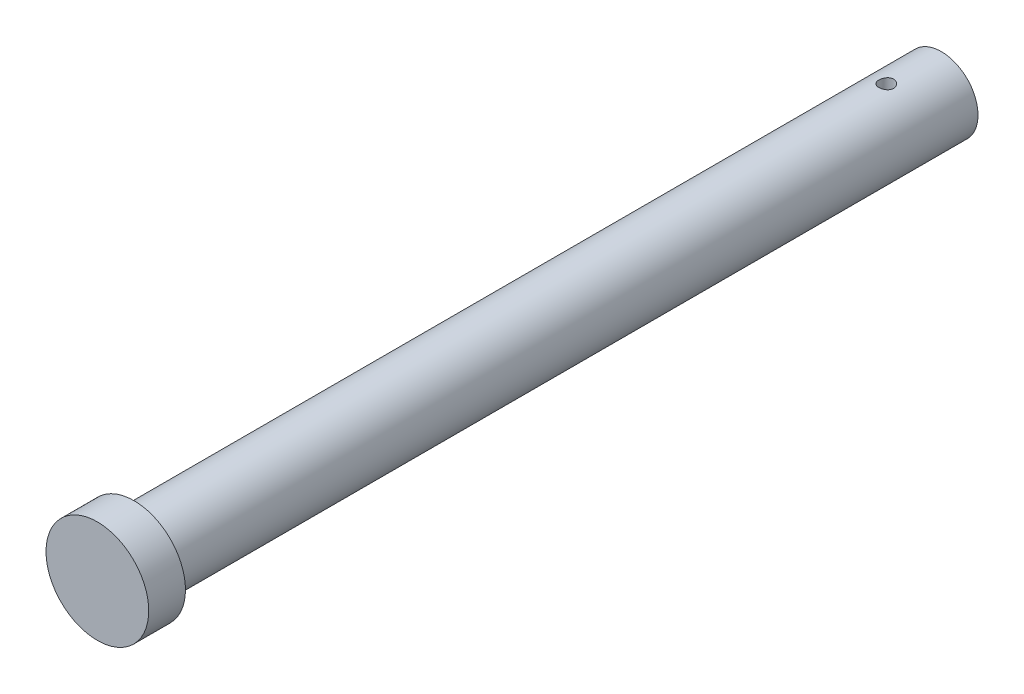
SolidWorks part; units mm, degrees
ref_plane "Ebene vorne" through (0, 0, 0) normal (0, 0, 1) x (1, 0, 0)
ref_plane "Ebene oben" through (0, 0, 0) normal (0, 1, 0) x (1, 0, 0)
ref_plane "Ebene rechts" through (0, 0, 0) normal (1, 0, 0) x (0, 0, -1)
sketch "Skizze1" plane through (0, 0, 0) normal (0, 0, 1) x (1, 0, 0)
  circle A0 centre (0, 0) radius 5
extrude "Linear austragen1" add sketch "Skizze1" along normal blind 75 and the other way blind 35
sketch "Skizze2" plane through (0, 0, 75) normal (0, 0, 1) x (1, 0, 0)
  circle A0 centre (0, 0) radius 7
extrude "Linear austragen2" add sketch "Skizze2" along normal blind 5
sketch "Skizze3" plane through (0, 0, 0) normal (0, 1, 0) x (1, 0, 0)
  line L0 (5, 35) -> (-5, 35) construction
  line L1 (5, -75) -> (5, 35) construction
  circle A0 centre (0, 27.5) radius 1
  dimension "D1" = 7.5
  dimension "D2" = 5
extrude "Schnitt-Linear austragen1" cut sketch "Skizze3" against normal blind 10 and the other way blind 30
